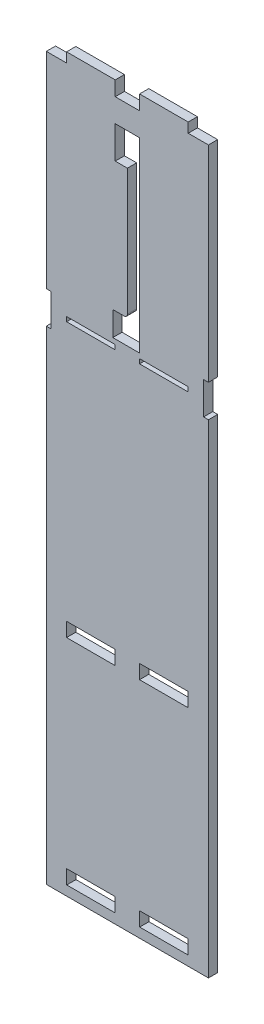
SolidWorks part; units mm, degrees
ref_plane "Alzado" through (0, 0, 0) normal (0, 0, 1) x (1, 0, 0)
ref_plane "Planta" through (0, 0, 0) normal (0, 1, 0) x (1, 0, 0)
ref_plane "Vista lateral" through (0, 0, 0) normal (1, 0, 0) x (0, 0, -1)
sketch "Croquis1" plane through (0, 0, 0) normal (0, 0, 1) x (1, 0, 0)
  line L1 (-50, -222.5) -> (50, -222.5)
  line L2 (-50, -222.5) -> (-50, 222.5)
  line L3 (-50, 222.5) -> (50, 222.5)
  line L4 (50, -222.5) -> (50, 222.5)
  line L5 (-50, -222.5) -> (50, 222.5) construction
  line L6 (-50, 222.5) -> (50, -222.5) construction
  point P0 (0, 0)
  dimension "D1" = 445
  dimension "D2" = 100
extrude "Saliente-Extruir1" add sketch "Croquis1" along normal blind 5.7
sketch "Croquis2" plane through (0, 222.5, 0) normal (0, 1, 0) x (1, 0, 0)
  line L0 (50, 0) -> (-50, 0) construction
  line L1 (-37.5, 0) -> (-7.5, 0)
  line L2 (-37.5, 0) -> (-37.5, -5.7)
  line L3 (-37.5, -5.7) -> (-7.5, -5.7)
  line L4 (-7.5, 0) -> (-7.5, -5.7)
  line L5 (50, -5.7) -> (-50, -5.7) construction
  line L6 (-7.5, 0) -> (7.5, 0) construction
  line L7 (7.5, 0) -> (37.5, 0)
  line L8 (7.5, 0) -> (7.5, -5.7)
  line L9 (7.5, -5.7) -> (37.5, -5.7)
  line L10 (37.5, 0) -> (37.5, -5.7)
  line L11 (7.5, 0) -> (7.0583, -0.034) construction
  point P12 (0, 0)
  dimension "D1" = 30
  dimension "D2" = 30
  dimension "D3" = 15
extrude "Saliente-Extruir2" add sketch "Croquis2" along normal blind 6
sketch "Croquis4" plane through (0, 0, 5.7) normal (0, 0, 1) x (1, 0, 0)
  line L0 (0, 0) -> (50, 0) construction
  line L1 (-7.5, 222.5) -> (7.5, 222.5)
  line L2 (-7.5, 222.5) -> (-7.5, 219.5)
  line L3 (-7.5, 219.5) -> (7.5, 219.5)
  line L4 (7.5, 222.5) -> (7.5, 219.5)
  line L5 (50, -222.5) -> (50, 222.5) construction
  line L6 (-7.6, -216.5) -> (7.6, -216.5) construction
  line L7 (-37.4, -207.8) -> (-7.6, -207.8)
  line L8 (-37.4, -207.8) -> (-37.4, -216.5)
  line L9 (-37.4, -216.5) -> (-7.6, -216.5)
  line L10 (0, -222.5) -> (0, 222.5) construction
  line L11 (0, 105.1) -> (-9, 105.1)
  line L12 (-9, 105.1) -> (-9, 90.1)
  line L13 (-7.5, 205.1) -> (7.5, 205.1)
  line L14 (-37.5, 87.1) -> (-37.5, 84.3)
  line L15 (0, 90.1) -> (7.5, 90.1)
  line L16 (7.5, 205.1) -> (7.5, 90.1)
  line L17 (-7.5, 84.3) -> (-37.5, 84.3)
  line L18 (7.5, -75.7) -> (37.5, -75.7)
  line L19 (7.5, -75.7) -> (7.5, -84.4)
  line L20 (7.5, -84.4) -> (37.5, -84.4)
  line L21 (37.5, -75.7) -> (37.5, -84.4)
  line L22 (7.5, 87.1) -> (37.5, 87.1)
  line L23 (7.5, 87.1) -> (7.5, 84.3)
  line L24 (7.5, 84.3) -> (37.5, 84.3)
  line L25 (37.5, 87.1) -> (37.5, 84.3)
  line L26 (-7.5, 87.1) -> (-7.5, 84.3)
  line L27 (-7.5, 87.1) -> (-37.5, 87.1)
  line L28 (-37.5, -75.7) -> (-37.5, -84.4)
  line L29 (-7.5, -84.4) -> (-37.5, -84.4)
  line L30 (-7.5, -75.7) -> (-7.5, -84.4)
  line L31 (-7.5, -75.7) -> (-37.5, -75.7)
  line L32 (-7.5, 205.1) -> (-7.5, 185.1)
  line L33 (-9, 90.1) -> (0, 90.1)
  line L34 (-7.5, 185.1) -> (0, 185.1)
  line L35 (50, 222.5) -> (37.5, 222.5) construction
  line L36 (-50, 222.5) -> (-50, -222.5) construction
  line L37 (0, 185.1) -> (0, 105.1)
  line L38 (-7.6, -207.8) -> (-7.6, -216.5)
  line L39 (7.6, -207.8) -> (37.4, -207.8)
  line L40 (7.6, -207.8) -> (7.6, -216.5)
  line L41 (7.6, -216.5) -> (37.4, -216.5)
  line L42 (37.4, -207.8) -> (37.4, -216.5)
  line L43 (-50, -222.5) -> (50, -222.5) construction
  line L44 (-53, 75.7) -> (-47, 75.7)
  line L45 (-53, 75.7) -> (-53, 95.7)
  line L46 (-53, 95.7) -> (-47, 95.7)
  line L47 (-47, 75.7) -> (-47, 95.7)
  line L48 (-53, 75.7) -> (-47, 95.7) construction
  line L49 (-53, 95.7) -> (-47, 75.7) construction
  line L50 (50, -222.5) -> (50, 222.5) construction
  line L51 (53, 75.7) -> (47, 75.7)
  line L52 (53, 75.7) -> (53, 95.7)
  line L53 (53, 95.7) -> (47, 95.7)
  line L54 (47, 75.7) -> (47, 95.7)
  line L55 (53, 75.7) -> (47, 95.7) construction
  line L56 (53, 95.7) -> (47, 75.7) construction
  point P19 (0, 205.1)
  point P30 (-50, 85.7)
  point P33 (22.5, -75.7)
  point P34 (22.5, 87.1)
  point P46 (0, 90.1)
  point P51 (0, -216.5)
  point P52 (-22.5, -207.8)
  point P53 (22.5, -207.8)
  point P58 (0, -222.5)
  point P65 (50, 85.7)
  point P72 (-47, 85.7)
  point P73 (-37.5, 85.7)
  point P74 (37.5, 85.7)
  point P75 (47, 85.7)
  dimension "D1" = 3
  dimension "D2" = 17.4
  dimension "D3" = 8.7
  dimension "D4" = 22.5
  dimension "D5" = 30
  dimension "D6" = 30
  dimension "D7" = 2.8
  dimension "D8" = 22.5
  dimension "D9" = 160
  dimension "D10" = 7.5
  dimension "D11" = 115
  dimension "D12" = 3
  dimension "D13" = 20
  dimension "D14" = 7.5
  dimension "D15" = 45
  dimension "D16" = 29.8
  dimension "D17" = 29.8
  dimension "D18" = 8.7
  dimension "D19" = 6
  dimension "D20" = 9
  dimension "D21" = 15
  dimension "D22" = 20
  dimension "D23" = 20
  dimension "D24" = 6
  dimension "D25" = 6
extrude "Cortar-Extruir1" cut sketch "Croquis4" against normal up to next
fillet "Redondeo3" radius 2 1 edges at (0, 105.1, 2.85)
